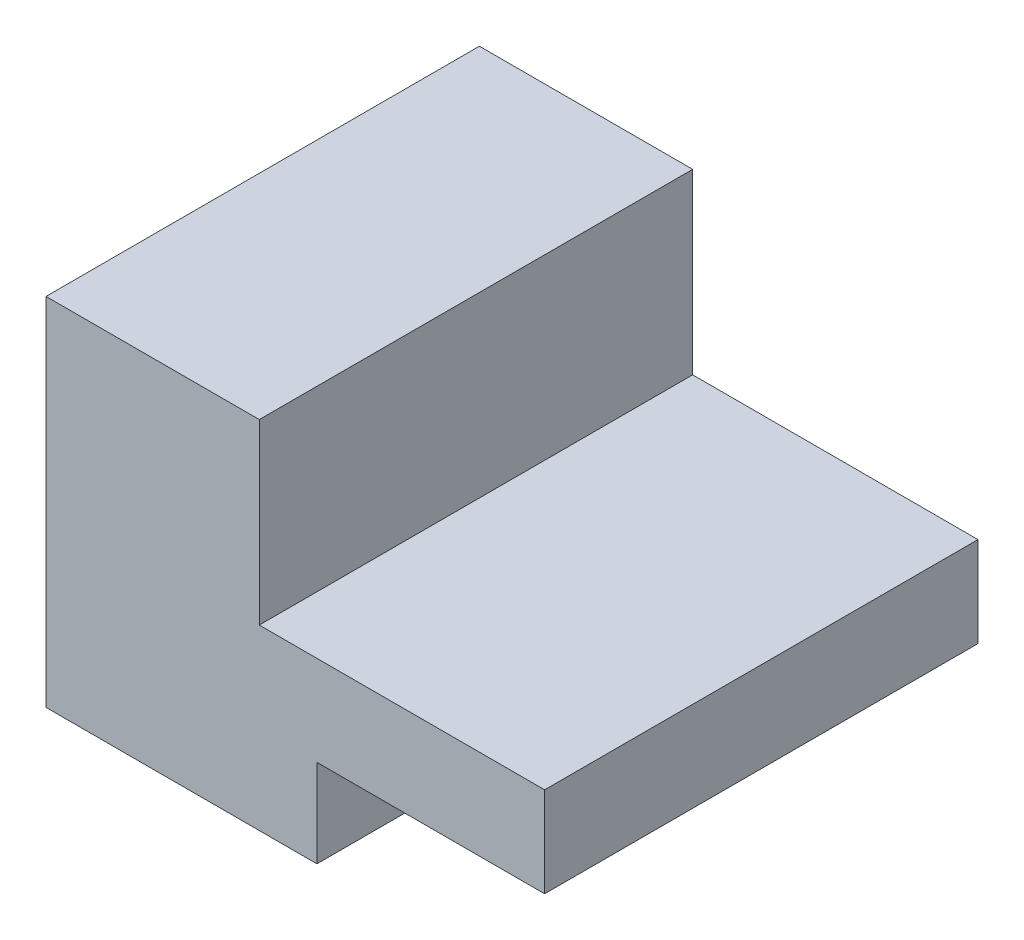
SolidWorks part; units mm, degrees
ref_plane "Face" through (0, 0, 0) normal (0, 0, 1) x (1, 0, 0)
ref_plane "Dessus" through (0, 0, 0) normal (0, 1, 0) x (1, 0, 0)
ref_plane "Droite" through (0, 0, 0) normal (1, 0, 0) x (0, 0, -1)
sketch "Esquisse2" plane through (0, 0, 0) normal (0, 0, 1) x (1, 0, 0)
  line L0 (-32.9593, 0) -> (-32.9593, 34.4955)
  line L1 (-32.9593, 34.4955) -> (-12.2899, 34.4955)
  line L2 (-12.2899, 34.4955) -> (-12.2899, 17.2477)
  line L3 (-12.2899, 17.2477) -> (15.3624, 17.2477)
  line L4 (15.3624, 17.2477) -> (15.3624, 8.5191)
  line L5 (15.3624, 8.5191) -> (-6.7036, 8.5191)
  line L6 (-6.7036, 8.5191) -> (-6.7036, 0)
  line L7 (-6.7036, 0) -> (-32.9593, 0)
extrude "Extrusion1" add sketch "Esquisse2" along normal blind 42
